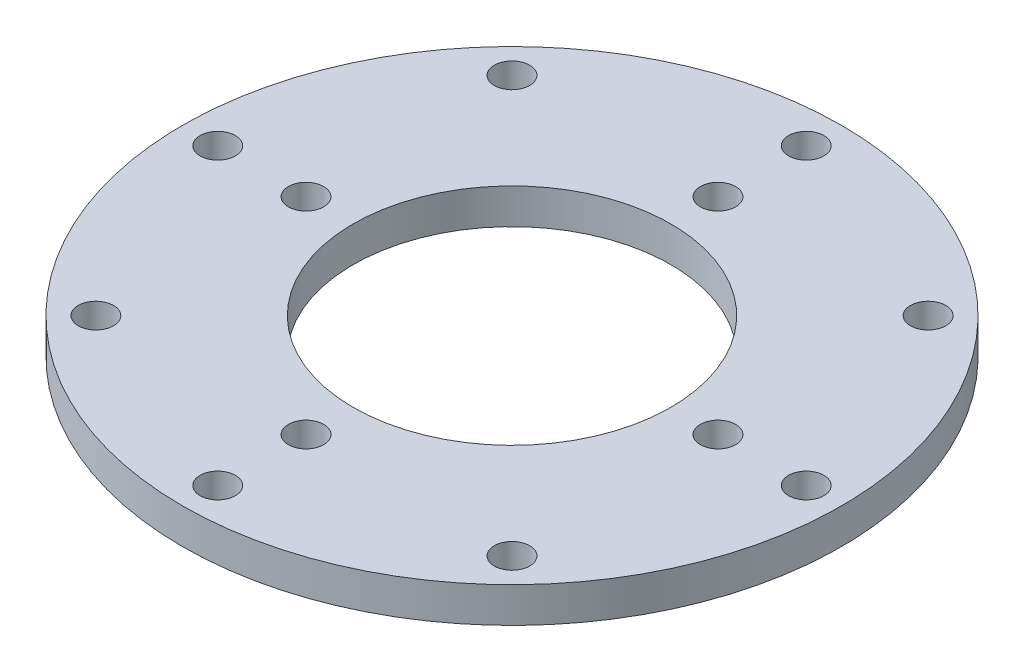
SolidWorks part; units mm, degrees
ref_plane "Front Plane" through (0, 0, 0) normal (0, 0, 1) x (1, 0, 0)
ref_plane "Top Plane" through (0, 0, 0) normal (0, 1, 0) x (1, 0, 0)
ref_plane "Right Plane" through (0, 0, 0) normal (1, 0, 0) x (0, 0, -1)
sketch "Sketch1" plane through (0, 0, 0) normal (0, 1, 0) x (1, 0, 0)
  circle A2 centre (0, 0) radius 28
  circle A3 centre (0, 0) radius 17.5 construction
  circle A4 centre (0, 0) radius 13.5
  circle A5 centre (0, 0) radius 21 construction
  circle A6 centre (0, -17.5) radius 1.5
  circle A7 centre (-17.5, 0) radius 1.5
  circle A8 centre (0, 17.5) radius 1.5
  circle A9 centre (17.5, 0) radius 1.5
  circle A10 centre (0, 0) radius 25 construction
  circle A11 centre (0, -25) radius 1.5
  circle A12 centre (-17.6777, -17.6777) radius 1.5
  circle A13 centre (-25, 0) radius 1.5
  circle A14 centre (-17.6777, 17.6777) radius 1.5
  circle A15 centre (0, 25) radius 1.5
  circle A16 centre (17.6777, 17.6777) radius 1.5
  circle A17 centre (25, 0) radius 1.5
  circle A18 centre (17.6777, -17.6777) radius 1.5
  point P4 (-12.4187, -21.6974)
  point P5 (0, 0)
  point P6 (0, 0)
  point P7 (0, 0)
  point P21 (0, 0)
  point P22 (0, 17.5)
  point P39 (0, 0)
  dimension "D2" = 27
  dimension "D4" = 35
  dimension "D5" = 42
  dimension "D6" = 3
  dimension "D8" = 50
  dimension "D9" = 3
  dimension "D3" = 56
  dimension "D7" = 4
  dimension "D10" = 8
extrude "Boss-Extrude1" add sketch "Sketch1" along normal blind 3
